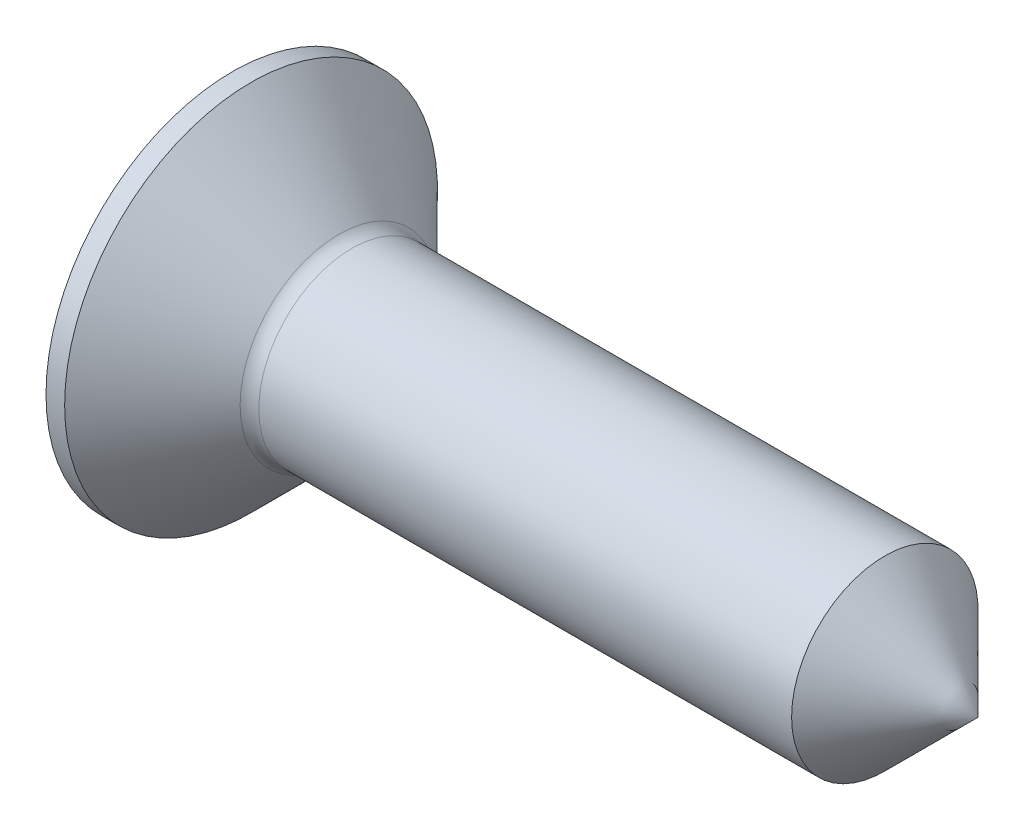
SolidWorks part; units mm, degrees
ref_plane "Front" through (0, 0, 0) normal (0, 0, 1) x (1, 0, 0)
ref_plane "Top" through (0, 0, 0) normal (0, 1, 0) x (1, 0, 0)
ref_plane "Right" through (0, 0, 0) normal (1, 0, 0) x (0, 0, -1)
sketch "Sketch1" plane through (0, 0, 0) normal (0, 1, 0) x (1, 0, 0)
  line L0 (-6.5065, 0) -> (5.6973, 0) construction
  line L1 (1.2, 1) -> (8, 1)
  line L2 (1.2, 1) -> (0.2, 2)
  line L3 (0.2, 2) -> (0, 2)
  line L4 (0, 2) -> (0, 0)
  line L5 (8, 1) -> (8, 0)
  line L6 (8, 0) -> (0, 0)
  dimension "D1" = 45
  dimension "d" = 2
  dimension "dk" = 4
  dimension "l" = 8
  dimension "k" = 1.2
revolve "Base" add sketch "Sketch1" angle 360 about L0
sketch "Sketch3" plane through (0, 0, 0) normal (0, 0, 1) x (1, 0, 0)
  line L0 (4.8835, 0) -> (6.2249, 0) construction
  line L2 (8.1576, 0) -> (8.1576, 20)
  line L3 (8.1576, 20) -> (-12, 20)
  line L4 (-12, 20) -> (8, 0)
  line L5 (8, 0) -> (8.1576, 0)
  line L7 (8, -1) -> (8, 1) construction
  dimension "D1" = 45
  dimension "D2" = 20
  dimension "D3" = 0.1576
revolve "Cut-Revolve1" cut sketch "Sketch3" angle 360 about L0
fillet "Fillet2" radius 0.2 1 edges at (1.2, 0, 1)
ref_plane "Plane1" through (1.45, 0, 0) normal (-1, 0, 0) x (0, 0, 1)
sketch "Sketch2" plane through (0, -0.6808, 0.3068) normal (-1, 0, 0) x (0, 0, 1)
  line L0 (-2.5747, 0.6808) -> (1.9612, 0.6808) construction
  line L1 (-0.3068, 2.9897) -> (-0.3068, -1.628) construction
  line L2 (-0.5568, 0.9308) -> (-1.5568, 0.9308)
  line L3 (-0.0568, -0.5692) -> (-0.5568, -0.5692)
  line L4 (-0.0568, -0.5692) -> (-0.0568, 0.4308)
  line L5 (-0.0568, 1.9308) -> (-0.5568, 1.9308)
  line L6 (-0.5568, -0.5692) -> (-0.5568, 0.4308)
  line L7 (0.9432, 0.9308) -> (-0.0568, 0.9308)
  line L8 (0.9432, 0.9308) -> (0.9432, 0.4308)
  line L9 (0.9432, 0.4308) -> (-0.0568, 0.4308)
  line L10 (-1.5568, 0.9308) -> (-1.5568, 0.4308)
  line L11 (-0.5568, 0.4308) -> (-1.5568, 0.4308)
  line L12 (-0.5568, 0.9308) -> (-0.5568, 1.9308)
  line L13 (-0.0568, 0.9308) -> (-0.0568, 1.9308)
  point P19 (-0.5568, 0.9308)
  point P24 (-0.0568, 0.9308)
  dimension "D1" = 0.5
  dimension "m" = 2.5
  dimension "D2" = 2.5
  dimension "D3" = 0.5
sketch "Sketch4" plane through (1.45, 0, 0) normal (-1, 0, 0) x (0, 0, 1)
  point P0 (0, 0)
loft "Cut-Loft1" cut profiles "Sketch2", "Sketch4"
sketch "Sketch5" plane through (0, 0, 0) normal (0, 0, 1) x (1, 0, 0)
  line L0 (4, 1.2) -> (4.25, 1.2)
  line L1 (4.25, 1.2) -> (4.25, 1)
  line L2 (4.25, 1) -> (4.125, 0.7835)
  line L3 (4, 1) -> (4.125, 0.7835)
  line L4 (4, 1.2) -> (4, 1)
  line L5 (10.7743, 0) -> (0, 0) construction
  line L6 (4, 1) -> (4.25, 1) construction
  line L7 (4.125, 1) -> (4.125, 0.7835) construction
  line L8 (7, 1) -> (1.2828, 1) construction
  point P5 (4.125, 1.2)
  dimension "D1" = 0.2
  dimension "D2" = 0.25
  dimension "D3" = 4
revolve "Cut-Revolve10" [suppressed] cut sketch "Sketch5" angle 360 about L5
pattern_linear "LPattern10" [suppressed] count 8 spacing 0.5 along (1, 0, 0)
equation "\"D2@Sketch2\" = \"m@Sketch2\""
equation "\"D3@Sketch2\" = \"D1@Sketch2\""
equation "\"D1@Sketch2\" = \"m@Sketch2\" / 5"
equation "\"D1@Plane1\" = \"k@Sketch1\" + 0.25"
equation "\"D2@Sketch5\" =  ( \"d@Sketch1\" - \"D2@ThreadCosmetic1\" )  / 2"
equation "\"D3@Sketch5\" = \"D1@ThreadCosmetic1\" + \"d@Sketch1\" / 2"
equation "\"D3@LPattern10\" =\"D2@Sketch5\"* 2"
equation "\"D1@LPattern10\" = \"D3@Sketch5\" / \"D3@LPattern10\""
